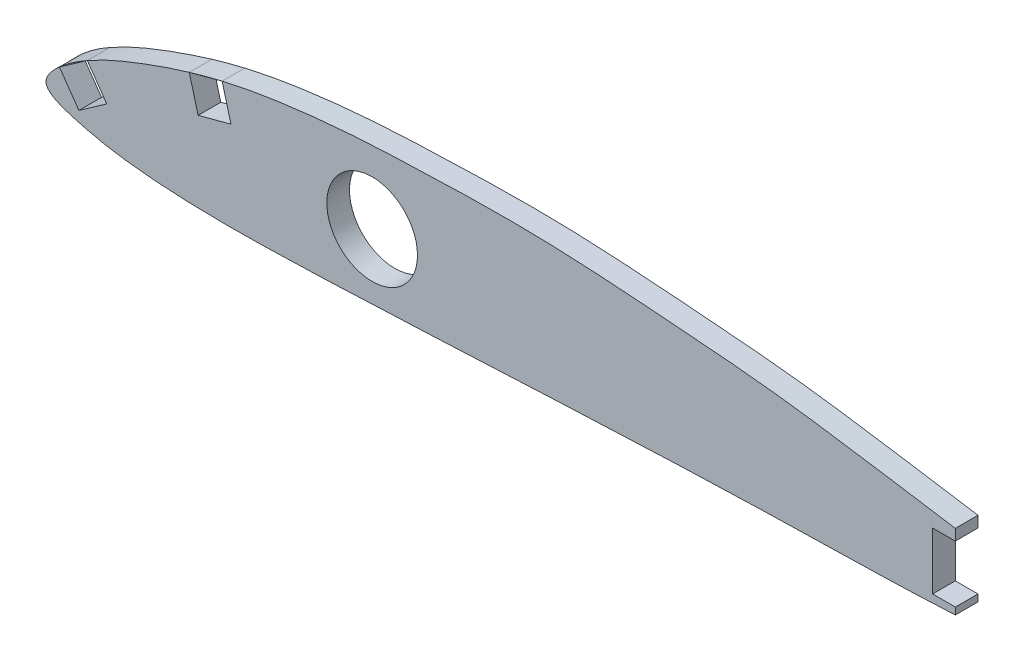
SolidWorks part; units mm, degrees
ref_plane "Front Plane" through (0, 0, 0) normal (0, 0, 1) x (1, 0, 0)
ref_plane "Top Plane" through (0, 0, 0) normal (0, 1, 0) x (1, 0, 0)
ref_plane "Right Plane" through (0, 0, 0) normal (1, 0, 0) x (0, 0, -1)
sketch3d "3DSketch1"
  line L0 (0, 0, 0) -> (171.36, 0, 0) construction
  spline S1 degree 3 poles (4.4393, -2.6363, 0) (-1.6403, -0.7209, 0) (1.9547, 2.9748, 0) (4.7981, 5.0113, 0) (8.4833, 6.9957, 0) (15.5406, 9.8665, 0) (24.1016, 12.5979, 0) (34.2353, 14.2184, 0) (42.8243, 15.0756, 0) (54.257, 15.5547, 0) (68.5623, 15.9605, 0) (85.6837, 14.7588, 0) (102.9287, 13.4151, 0) (119.7824, 10.7153, 0) (137.8619, 7.9513, 0) (151.6595, 4.7054, 0) (181.0301, -1.1124, 0) (143.0275, 0.2261, 0) (126.5011, -1.2863, 0) (90.825, -1.8487, 0) (62.9371, -3.3683, 0) (34.2241, -4.6198, 0) (20.1132, -4.8512, 0) (9.7268, -3.8453, 0) (4.4393, -2.6363, 0) (-1.6403, -0.7209, 0) (1.9547, 2.9748, 0) knots -0.051806 -0.027094 -0.014492 0 0.01056 0.018211 0.03221 0.045525 0.084069 0.108974 0.133649 0.158233 0.207343 0.256523 0.305826 0.355445 0.405214 0.45539 0.506007 0.555122 0.65337 0.70249 0.849939 0.899083 0.948194 0.972906 0.985508 1 1.01056 1.018211 1.03221 only from (0, 0, 0) to (0, 0, 0)
  dimension "D1" = 171.36
extrude "Boss-Extrude1" add sketch "3DSketch1" along direction (0, 0, 1) on the side of the normal blind 3.175
sketch "Sketch1" plane through (0, 0, 3.175) normal (0, 0, 1) x (1, 0, 0)
  line L0 (0, 0) -> (171.36, 0) construction
  line L1 (85.68, 0) -> (85.68, 5) construction
  line L2 (85.68, 5) -> (45.68, 5) construction
  line L3 (127.362, 0) -> (127.362, -12.1994)
  line L4 (127.362, 17.1037) -> (187.362, 17.1037)
  line L5 (127.362, 17.1037) -> (127.362, 8)
  line L6 (127.362, -12.1994) -> (187.362, -12.1994)
  line L7 (187.362, 17.1037) -> (187.362, -12.1994)
  line L8 (124.187, 8) -> (127.362, 8)
  line L9 (124.187, 8) -> (124.187, 0)
  line L10 (124.187, 0) -> (127.362, 0)
  line L11 (5.7801, 5.4986) -> (1.8789, 2.767)
  line L12 (5.7801, 5.4986) -> (8.5117, 1.5974)
  line L13 (1.8789, 2.767) -> (4.6105, -1.1342)
  line L14 (8.5117, 1.5974) -> (4.6105, -1.1342)
  line L15 (20.0713, 11.2119) -> (24.6715, 12.4445)
  line L16 (20.0713, 11.2119) -> (21.3039, 6.6117)
  line L17 (24.6715, 12.4445) -> (25.9042, 7.8443)
  line L18 (21.3039, 6.6117) -> (25.9042, 7.8443)
  circle A0 centre (45.68, 5) radius 6.35
  spline S0 degree 3 poles (1.9547, 2.9748) (-1.6403, -0.7209) (4.4393, -2.6363) (9.7268, -3.8453) (20.1132, -4.8512) (34.2241, -4.6198) (62.9371, -3.3683) (90.825, -1.8487) (126.5011, -1.2863) (143.0275, 0.2261) (181.0301, -1.1124) (151.6595, 4.7054) (137.8619, 7.9513) (119.7824, 10.7153) (102.9287, 13.4151) (85.6837, 14.7588) (68.5623, 15.9605) (54.257, 15.5547) (42.8243, 15.0756) (34.2353, 14.2184) (24.1016, 12.5979) (15.5406, 9.8665) (8.4833, 6.9957) (4.7981, 5.0113) (1.9547, 2.9748) (-1.6403, -0.7209) (4.4393, -2.6363) knots -0.03221 -0.018211 -0.01056 0 0.014492 0.027094 0.051806 0.100917 0.150061 0.29751 0.34663 0.444878 0.493993 0.54461 0.594786 0.644555 0.694174 0.743477 0.792657 0.841767 0.866351 0.891026 0.915931 0.954475 0.96779 0.981789 0.98944 1 1.014492 1.027094 1.051806 only from (0, 0) to (0, 0) construction
  dimension "D3" = 41.682
  dimension "D1" = 5
  dimension "D2" = 40
  dimension "D4" = 60
  dimension "D5" = 8
  dimension "D6" = 3.175
  dimension "D7" = 4.7625
  dimension "D8" = 4.7625
  dimension "D9" = 55
  dimension "D10" = 4.7625
  dimension "D11" = 4.7625
  dimension "D12" = 75
extrude "Cut-Extrude1" cut sketch "Sketch1" against normal blind 10
